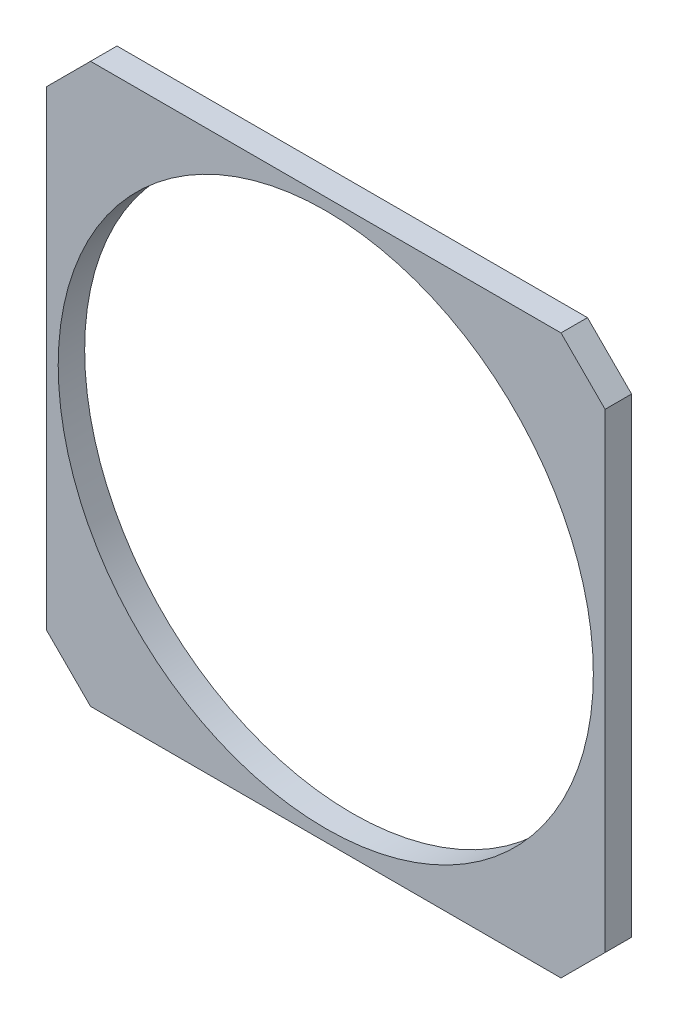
SolidWorks part; units mm, degrees
ref_plane "Front Plane" through (0, 0, 0) normal (0, 0, 1) x (1, 0, 0)
ref_plane "Top Plane" through (0, 0, 0) normal (0, 1, 0) x (1, 0, 0)
ref_plane "Right Plane" through (0, 0, 0) normal (1, 0, 0) x (0, 0, -1)
sketch "Sketch1" plane through (0, 0, 0) normal (0, 0, 1) x (1, 0, 0)
  circle A0 centre (0, 0) radius 47.75
  circle A1 centre (0, 0) radius 45.5
  dimension "D1" = 95.5
  dimension "D2" = 91
sketch "Sketch2" plane through (0, 0, 0) normal (0, 0, 1) x (1, 0, 0)
  line L0 (-40, 47.5) -> (40, 47.5)
  line L1 (-53, 53) -> (53, 53) construction
  line L2 (-53, 53) -> (-53, -53) construction
  line L3 (-53, -53) -> (53, -53) construction
  line L4 (53, 53) -> (53, -53) construction
  line L5 (40, 47.5) -> (47.5, 40)
  line L6 (47.5, 40) -> (47.5, -40)
  line L7 (47.5, -40) -> (40, -47.5)
  line L8 (40, -47.5) -> (-40, -47.5)
  line L9 (-40, -47.5) -> (-47.5, -40)
  line L10 (-47.5, -40) -> (-47.5, 40)
  line L11 (-47.5, 40) -> (-40, 47.5)
  circle A0 centre (0, 0) radius 45.5
  dimension "D2" = 13
  dimension "D7" = 91
  dimension "D3" = 5.5
  dimension "D4" = 5.5
  dimension "D5" = 5.5
  dimension "D6" = 5.5
  dimension "D8" = 13
  dimension "D9" = 13
  dimension "D10" = 13
  dimension "D11" = 13
  dimension "D12" = 13
extrude "Boss-Extrude1" add sketch "Sketch2" along normal blind 4.5
